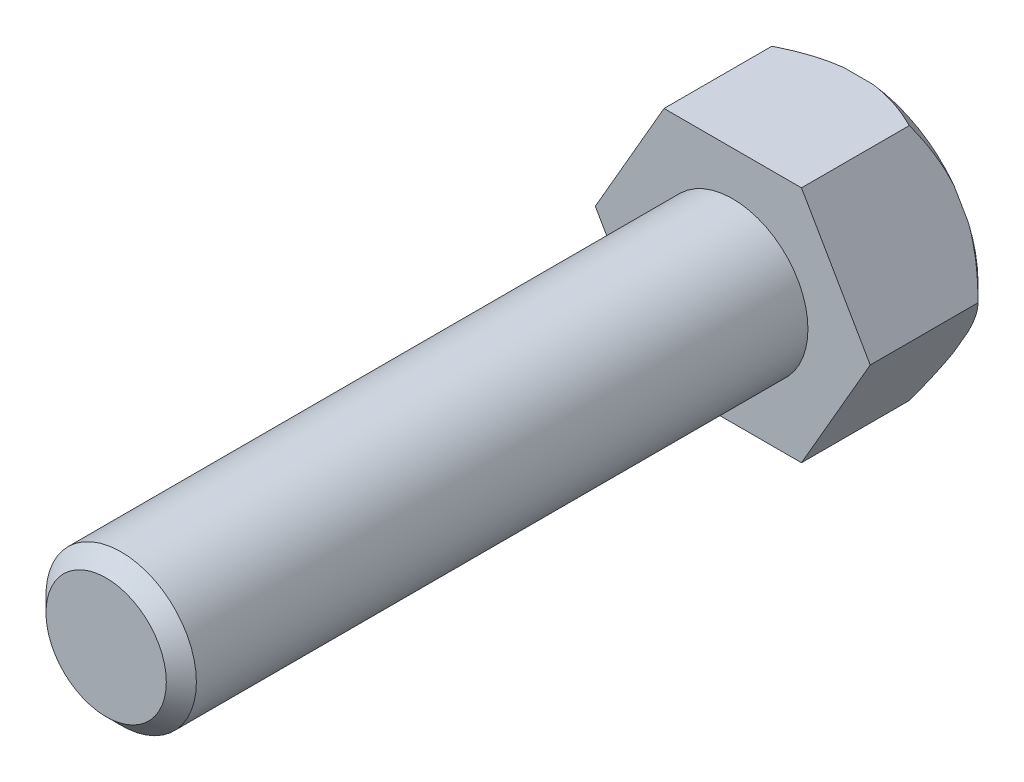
SolidWorks part; units mm, degrees
ref_plane "Plan de face" through (0, 0, 0) normal (0, 0, 1) x (1, 0, 0)
ref_plane "Plan de dessus" through (0, 0, 0) normal (0, 1, 0) x (1, 0, 0)
ref_plane "Plan de droite" through (0, 0, 0) normal (1, 0, 0) x (0, 0, -1)
sketch "Esquisse1" plane through (0, 0, 0) normal (0, 0, 1) x (1, 0, 0)
  line L1 (10.9697, 0) -> (5.4848, 9.5)
  line L2 (5.4848, 9.5) -> (-5.4848, 9.5)
  line L3 (-5.4848, 9.5) -> (-10.9697, 0)
  line L4 (-10.9697, 0) -> (-5.4848, -9.5)
  line L5 (-5.4848, -9.5) -> (5.4848, -9.5)
  line L6 (5.4848, -9.5) -> (10.9697, 0)
  circle A0 centre (0, 0) radius 9.5 construction
  dimension "D1" = 19
extrude "Boss.-Extru.1" add sketch "Esquisse1" along normal blind 10
sketch "Esquisse2" plane through (0, 0, 10) normal (0, 0, 1) x (1, 0, 0)
  circle A0 centre (0, 0) radius 6
  dimension "D1" = 12
extrude "Boss.-Extru.2" add sketch "Esquisse2" along normal blind 50
chamfer "Chanfrein1" distance 1.2 angle 45 1 edges at (6, 0, 60)
sketch "Esquisse3" plane through (0, 0, 0) normal (0, 1, 0) x (1, 0, 0)
  line L0 (10.9697, 0) -> (9.5697, 0)
  line L1 (10.9697, 0) -> (5.4848, 0) construction
  line L2 (9.5697, 0) -> (10.9697, -1.4)
  line L3 (10.9697, -1.4) -> (10.9697, 0)
  line L4 (0, 0) -> (0, -3.7284) construction
  dimension "D1" = 1.4
  dimension "D2" = 1.4
revolve "Enlèvement de matière-Révolution1" cut sketch "Esquisse3" angle 360 about L4
